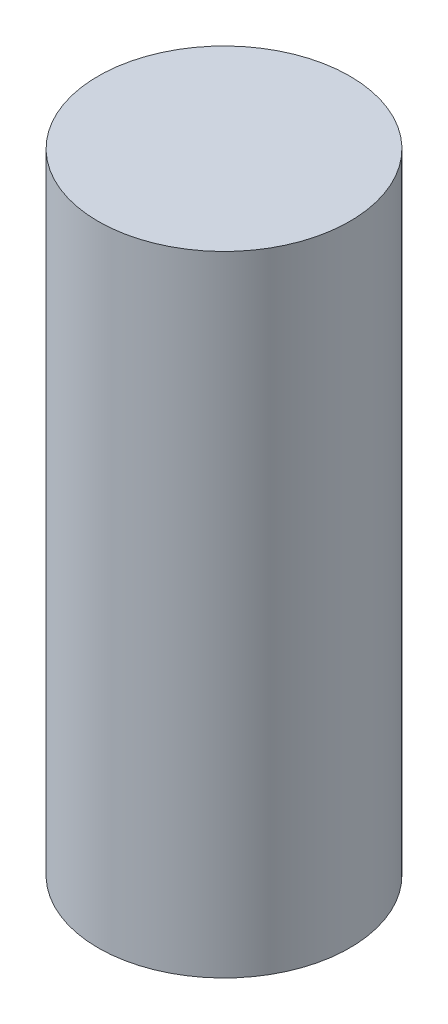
SolidWorks part; units mm, degrees
ref_plane "Plan de face" through (0, 0, 0) normal (0, 0, 1) x (1, 0, 0)
ref_plane "Plan de dessus" through (0, 0, 0) normal (0, 1, 0) x (1, 0, 0)
ref_plane "Plan de droite" through (0, 0, 0) normal (1, 0, 0) x (0, 0, -1)
sketch "Esquisse1" plane through (0, 0, 0) normal (0, 1, 0) x (1, 0, 0)
  circle A0 centre (0, 0) radius 5
  dimension "D1" = 10
extrude "Extrusion1" add sketch "Esquisse1" along normal blind 20
sketch "Esquisse3" plane through (0, 20, 0) normal (0, 1, 0) x (-1, 0, 0)
  circle A0 centre (0, 0) radius 4
extrude "Extrusion2" cut sketch "Esquisse3" against normal blind 24 flip side to cut
sketch "Esquisse4" plane through (0, 0, 0) normal (0, -1, 0) x (1, 0, 0)
  circle A0 centre (0, 0) radius 4
